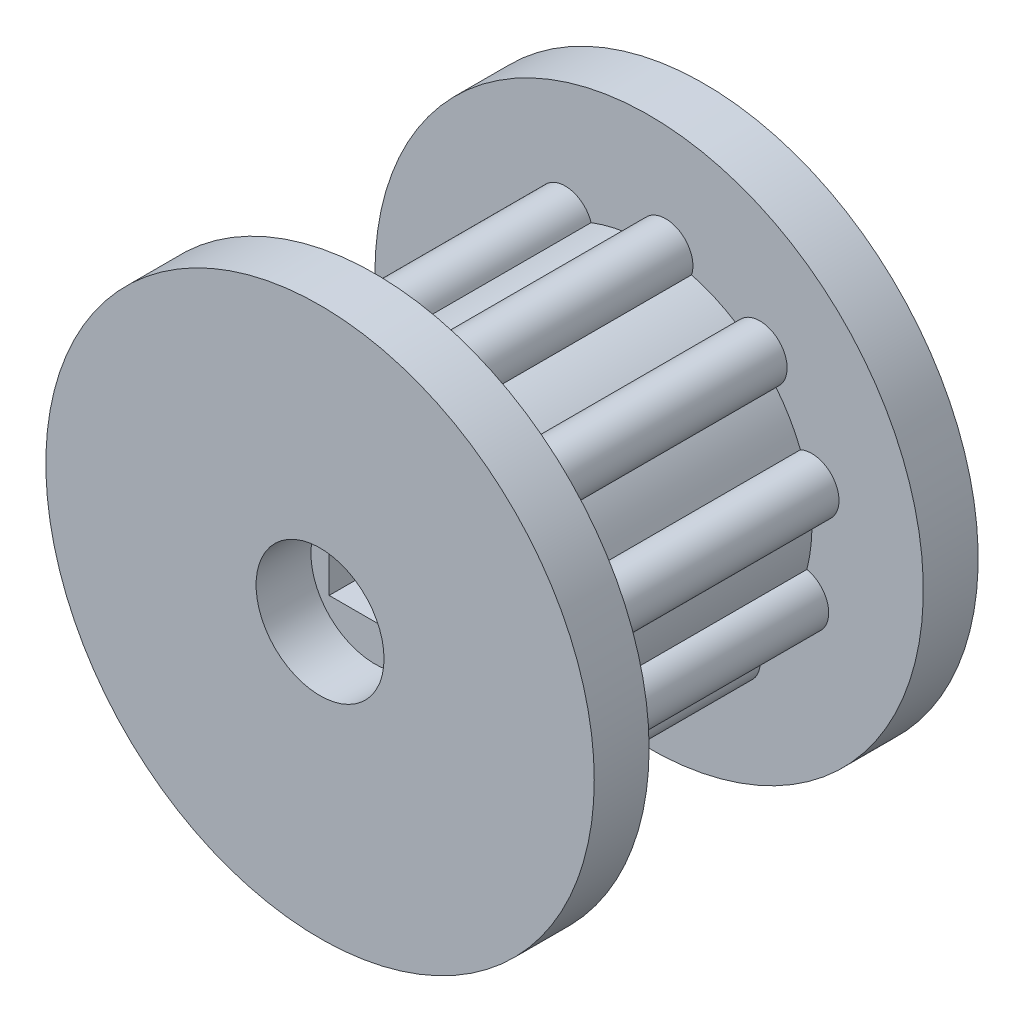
SolidWorks part; units mm, degrees
ref_plane "Front Plane" through (0, 0, 0) normal (0, 0, 1) x (1, 0, 0)
ref_plane "Top Plane" through (0, 0, 0) normal (0, 1, 0) x (1, 0, 0)
ref_plane "Right Plane" through (0, 0, 0) normal (1, 0, 0) x (0, 0, -1)
imported_body "Pulley part01 GT2 6mm.STEP"
ref_plane "Plane1" through (0, 0, 0) normal (0, 0, 1) x (1, 0, 0)
sketch "Sketch1" plane through (0, 0, 0) normal (0, 0, 1) x (1, 0, 0)
  arc A0 (15.775, 0) -> (-15.775, 0) centre (0, 0) ccw
  arc A1 (-3.2, 0) -> (3.2, 0) centre (0, 0) ccw
  arc A2 (3.2, 0) -> (-3.2, 0) centre (0, 0) ccw
  arc A3 (-15.775, 0) -> (15.775, 0) centre (0, 0) ccw
  arc A4 (-15.775, 0) -> (15.775, 0) centre (0, 0) ccw
  arc A5 (3.2, 0) -> (-3.2, 0) centre (0, 0) ccw
  arc A6 (-3.2, 0) -> (3.2, 0) centre (0, 0) ccw
  arc A7 (15.775, 0) -> (-15.775, 0) centre (0, 0) ccw
ref_plane "Plane2" through (0, 0, 5) normal (0, 0, 1) x (1, 0, 0)
sketch "Sketch2" plane through (0, 0, 5) normal (0, 0, 1) x (1, 0, 0)
  line L1 (-2.5, -1.5) -> (2.5, -1.5)
  line L2 (-2.5, -1.5) -> (-2.5, 1.5)
  line L3 (-2.5, 1.5) -> (2.5, 1.5)
  line L4 (2.5, -1.5) -> (2.5, 1.5)
  line L5 (-2.5, -1.5) -> (2.5, 1.5) construction
  line L6 (-2.5, 1.5) -> (2.5, -1.5) construction
  arc A0 (6.9341, 5.5905) -> (4.7632, 7.5264) centre (6.0606, 6.7961) ccw
  arc A1 (8.8958, 0.447) -> (8.2775, 3.2892) centre (8.8977, 1.9358) ccw
  arc A2 (7.4596, -4.8672) -> (8.63, -2.2043) centre (8.3362, -3.6638) ccw
  arc A3 (3.1741, -8.3223) -> (5.6861, -6.8559) centre (4.5906, -7.864) ccw
  arc A4 (-2.3238, -8.5986) -> (0.5704, -8.8888) centre (-0.9085, -9.0604) ccw
  arc A5 (-6.9341, -5.5905) -> (-4.7632, -7.5264) centre (-6.0606, -6.7961) ccw
  arc A6 (-8.8958, -0.447) -> (-8.2775, -3.2892) centre (-8.8977, -1.9358) ccw
  arc A7 (-7.4596, 4.8672) -> (-8.63, 2.2043) centre (-8.3362, 3.6638) ccw
  arc A8 (-3.1741, 8.3223) -> (-5.6861, 6.8559) centre (-4.5906, 7.864) ccw
  arc A9 (2.3238, 8.5986) -> (-0.5704, 8.8888) centre (0.9085, 9.0604) ccw
  arc A10 (4.7632, 7.5264) -> (2.3238, 8.5986) centre (0, 0) ccw
  arc A11 (-0.5704, 8.8888) -> (-3.1741, 8.3223) centre (0, 0) ccw
  arc A12 (-5.6861, 6.8559) -> (-7.4596, 4.8672) centre (0, 0) ccw
  arc A13 (-8.63, 2.2043) -> (-8.8958, -0.447) centre (0, 0) ccw
  arc A14 (-8.2775, -3.2892) -> (-6.9341, -5.5905) centre (0, 0) ccw
  arc A15 (-4.7632, -7.5264) -> (-2.3238, -8.5986) centre (0, 0) ccw
  arc A16 (0.5704, -8.8888) -> (3.1741, -8.3223) centre (0, 0) ccw
  arc A17 (5.6861, -6.8559) -> (7.4596, -4.8672) centre (0, 0) ccw
  arc A18 (8.63, -2.2043) -> (8.8958, 0.447) centre (0, 0) ccw
  arc A19 (8.2775, 3.2892) -> (6.9341, 5.5905) centre (0, 0) ccw
  point P1 (0, 0)
  point P39 (0, 0)
  point P1335 (0, 0)
  dimension "D3" = 10
  dimension "D1" = 3
  dimension "D2" = 5
extrude "Boss-Extrude1" add sketch "Sketch2" along normal blind 15 separate body
sketch "Sketch3" plane through (0, 0, 5) normal (0, 0, -1) x (-1, 0, 0)
  circle A0 centre (0, 0) radius 15
  circle A1 centre (0, 0) radius 3.5
  dimension "D1" = 30
  dimension "D2" = 7
extrude "Boss-Extrude2" add sketch "Sketch3" along normal blind 3
sketch "Sketch4" plane through (0, 0, 20) normal (0, 0, 1) x (1, 0, 0)
  circle A0 centre (0, 0) radius 15
  circle A1 centre (0, 0) radius 3.5
  dimension "D1" = 7
  dimension "D2" = 30
extrude "Boss-Extrude3" add sketch "Sketch4" along normal blind 3
